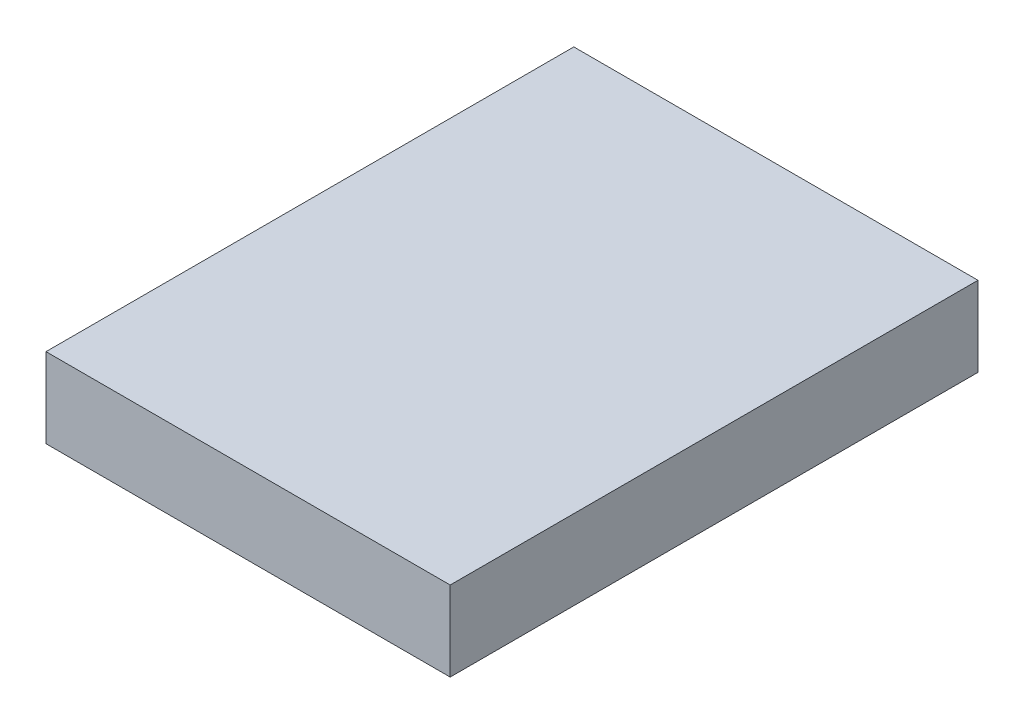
SolidWorks part; units mm, degrees
ref_plane "Front Plane" through (0, 0, 0) normal (0, 0, 1) x (1, 0, 0)
ref_plane "Top Plane" through (0, 0, 0) normal (0, 1, 0) x (1, 0, 0)
ref_plane "Right Plane" through (0, 0, 0) normal (1, 0, 0) x (0, 0, -1)
sketch "Sketch1" plane through (0, 0, 0) normal (0, 1, 0) x (1, 0, 0)
  line L0 (50.6824, -66.1847) -> (-50.6824, 66.1847) construction
  line L1 (-50.6824, -66.1847) -> (50.6824, -66.1847)
  line L2 (-50.6824, -66.1847) -> (-50.6824, 66.1847)
  line L3 (-50.6824, 66.1847) -> (50.6824, 66.1847)
  line L4 (50.6824, -66.1847) -> (50.6824, 66.1847)
extrude "Extrude1" add sketch "Sketch1" along normal blind 20
sketch "Sketch2" plane through (0, 20, 0) normal (0, 1, 0) x (1, 0, 0)
  line L1 (-20.3118, -37.7741) -> (11.2522, -37.7741)
  line L2 (-20.3118, -37.7741) -> (-20.3118, 19.557)
  line L3 (-20.3118, 19.557) -> (11.2522, 19.557)
  line L4 (11.2522, -37.7741) -> (11.2522, 19.557)
sketch "Sketch3" plane through (0, 0, 66.1847) normal (0, 0, 1) x (1, 0, 0)
  line L1 (-50.6824, 0) -> (-91.5848, 96.0781)
